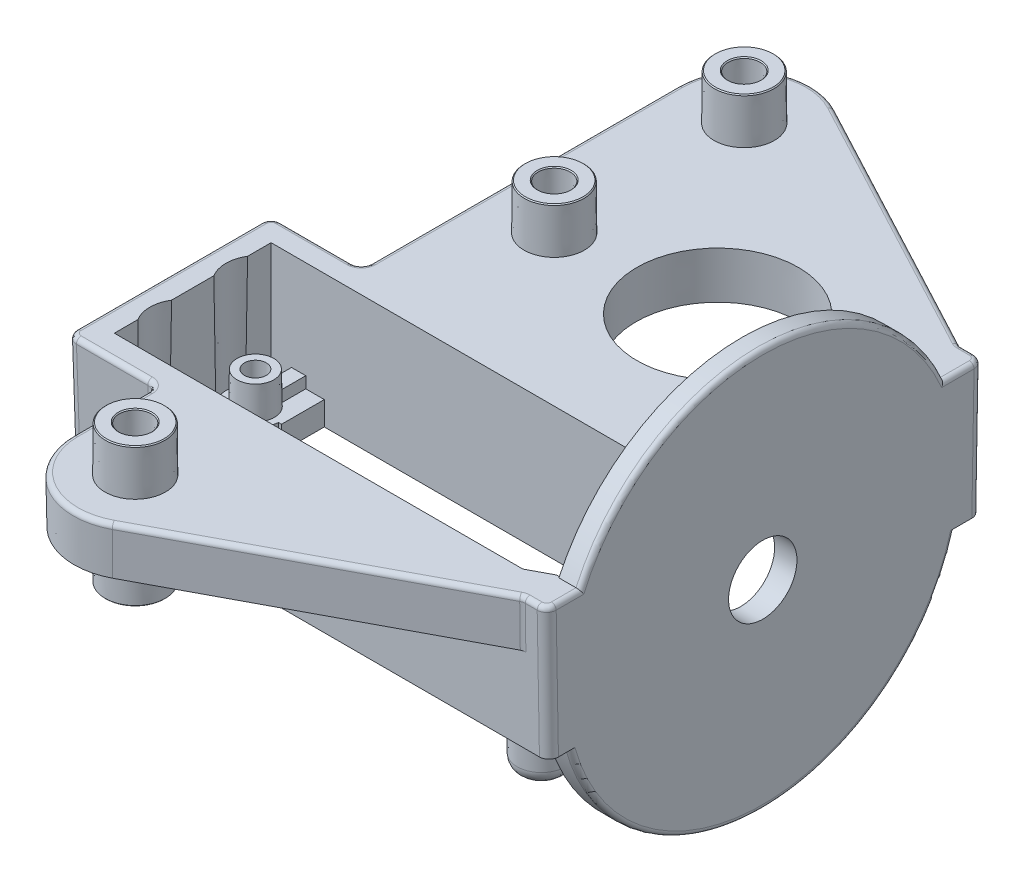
SolidWorks part; units mm, degrees
ref_plane "前视基准面" through (0, 0, 0) normal (0, 0, 1) x (1, 0, 0)
ref_plane "上视基准面" through (0, 0, 0) normal (0, 1, 0) x (1, 0, 0)
ref_plane "右视基准面" through (0, 0, 0) normal (1, 0, 0) x (0, 0, -1)
imported_body "Imported1"
other "移动面1" parameters "D1"=0.3
other "移动面2" parameters "D1"=0.3
other "移动面3" parameters "D1"=0.3
other "移动面4" parameters "D1"=0.3
other "移动面5" parameters "D1"=0.25
other "移动面6" parameters "D1"=0.25
other "移动面7" parameters "D1"=0.25
other "移动面8" parameters "D1"=0.25
other "移动面9" parameters "D1"=0.25
other "移动面10" parameters "D1"=0.25
